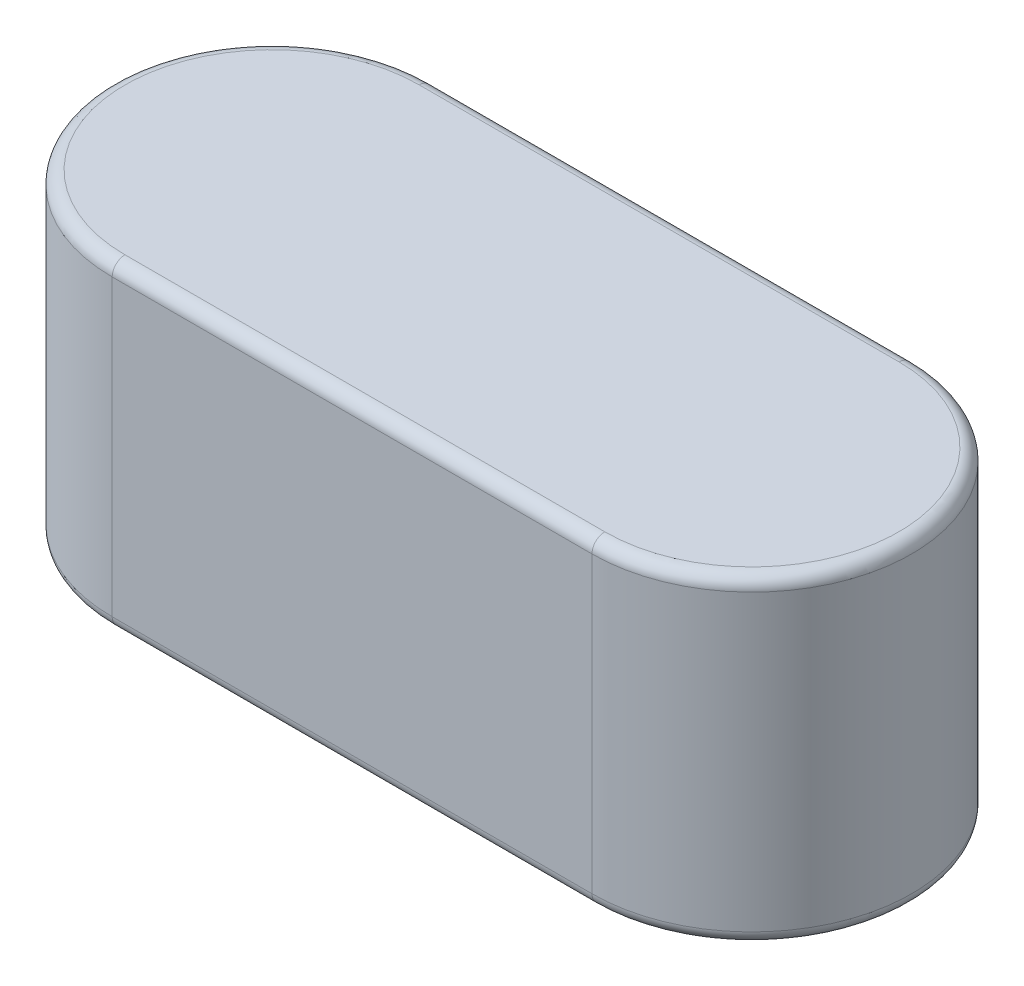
SolidWorks part; units mm, degrees
ref_plane "Front Plane" through (0, 0, 0) normal (0, 0, 1) x (1, 0, 0)
ref_plane "Top Plane" through (0, 0, 0) normal (0, 1, 0) x (1, 0, 0)
ref_plane "Right Plane" through (0, 0, 0) normal (1, 0, 0) x (0, 0, -1)
other "Configuration Table"
sketch "Sketch1" plane through (0, 0, 0) normal (0, 1, 0) x (1, 0, 0)
  line L1 (-6, 2) -> (0, 2)
  line L3 (-6, -2) -> (0, -2)
  arc A0 (0, -2) -> (0, 2) centre (0, 0) ccw
  arc A1 (-6, 2) -> (-6, -2) centre (-6, 0) ccw
  dimension "l" = 10
  dimension "b" = 4
extrude "Extrude1" add sketch "Sketch1" along normal blind 4
fillet "Fillet1" radius 0.16 8 edges at (-3, 0, -2) (2, 0, 0) (-8, 0, 0) (-3, 0, 2) (2, 4, 0) (-3, 4, 2) (-3, 4, -2) (-8, 4, 0)
